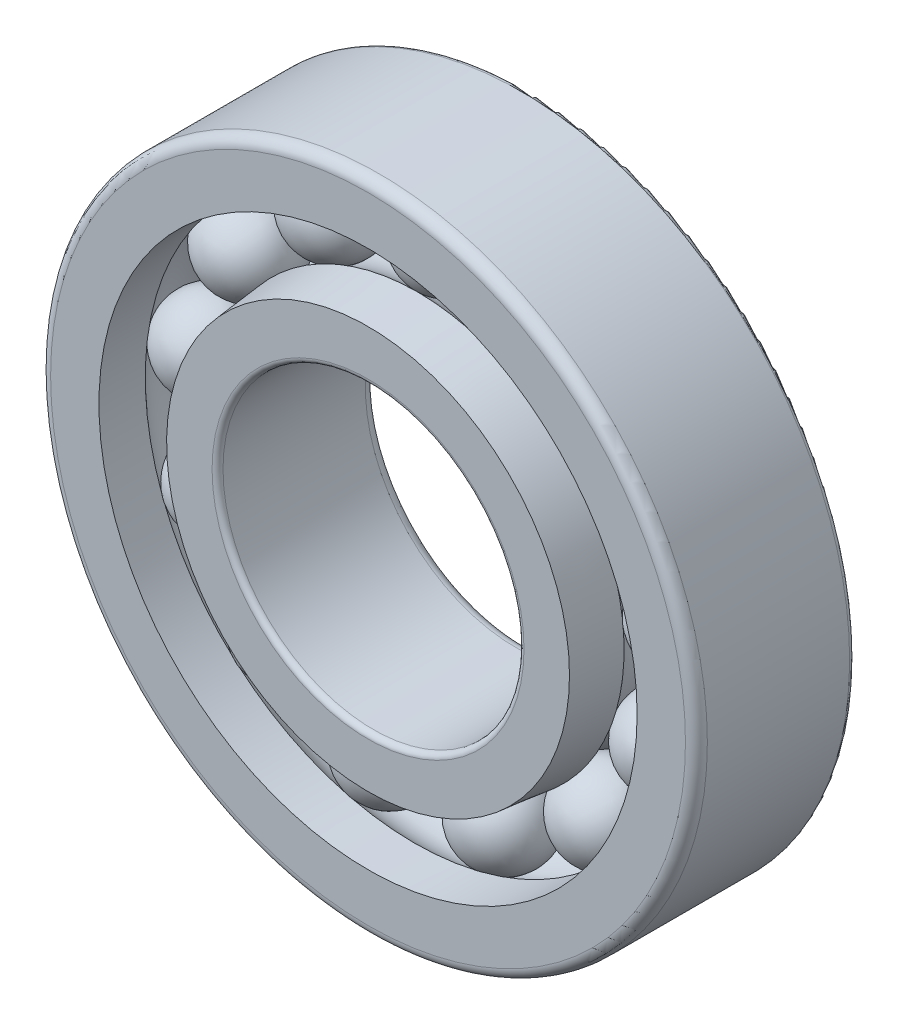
SolidWorks part; units mm, degrees
ref_plane "Front Plane" through (0, 0, 0) normal (0, 0, 1) x (1, 0, 0)
ref_plane "Top Plane" through (0, 0, 0) normal (0, 1, 0) x (1, 0, 0)
ref_plane "Right Plane" through (0, 0, 0) normal (1, 0, 0) x (0, 0, -1)
sketch "BaseSke" plane through (0, 0, 0) normal (1, 0, 0) x (0, 0, -1)
  line L0 (-47.2296, 0) -> (24.6132, 0) construction
  line L1 (-47.2296, 43.75) -> (24.6132, 43.75) construction
  line L2 (0, 129.5214) -> (0, -86.3012) construction
  line L3 (0, 51.875) -> (0, 35.625)
  line L4 (-14.5, 60) -> (14.5, 60) construction
  line L5 (-14.5, 27.5) -> (14.5, 27.5) construction
  arc A0 (0, 51.875) -> (0, 35.625) centre (0, 43.75) ccw
  dimension "Ball_diameter" = 16.25
  dimension "D1" = 43.75
  dimension "Bearing_Thickness" = 29
  dimension "Bearing_Outside_Diameter" = 120
  dimension "Bearing_Inside_Diameter" = 55
revolve "Ball" add sketch "BaseSke" angle 360 about L3
sketch "OuterRaceSke" plane through (0, 0, 0) normal (1, 0, 0) x (0, 0, -1)
  line L0 (0, 0) -> (0, 87.5396) construction
  line L1 (-14.5, 60) -> (14.5, 60)
  line L2 (-14.5, 60) -> (-14.5, 49.1667)
  line L3 (-14.5, 49.1667) -> (-6.0426, 49.1667)
  line L4 (14.5, 60) -> (14.5, 50.6907)
  line L5 (-50.3916, 0) -> (55.2197, 0) construction
  line L6 (-47.2296, 43.75) -> (24.6132, 43.75) construction
  line L8 (14.5, 50.6907) -> (5.4727, 49.7419)
  line L9 (0, 49.1667) -> (-2.5325, 58.6181) construction
  line L10 (0, 49.1667) -> (5.4727, 49.7419) construction
  arc A0 (5.4727, 49.7419) -> (-6.0426, 49.1667) centre (0, 43.75) ccw
  dimension "D4" = 16.23
  dimension "D2" = 98.3333
  dimension "D3" = 6
  dimension "Angle" = 15
revolve "OuterRace" add sketch "OuterRaceSke" angle 360 about L5
sketch "InnerRaceSke" plane through (0, 0, 0) normal (1, 0, 0) x (0, 0, -1)
  line L0 (-70.8626, 0) -> (113.5527, 0) construction
  line L1 (0, 58.441) -> (0, -70.8113) construction
  line L2 (-14.5, 27.5) -> (14.5, 27.5)
  line L3 (-14.5, 27.5) -> (-14.5, 38.3333)
  line L4 (-14.5, 38.3333) -> (-6.0426, 38.3333)
  line L5 (14.5, 27.5) -> (14.5, 38.3333)
  line L6 (0, 129.5214) -> (0, -86.3012) construction
  line L7 (6.0426, 38.3333) -> (14.5, 38.3333)
  arc A0 (-6.0426, 38.3333) -> (6.0426, 38.3333) centre (0, 43.75) ccw
  arc A1 (0, 51.875) -> (0, 35.625) centre (0, 43.75) ccw construction
  dimension "D2" = 16.23
  dimension "D1" = 76.6667
revolve "InnerRace" add sketch "InnerRaceSke" angle 360 about L0
fillet "Fillet1" radius 2 2 edges at (27.5, 0, -14.5) (60, 0, 14.5)
fillet "Fillet2" radius 1 2 edges at (60, 0, -14.5) (27.5, 0, 14.5)
sketch "CutInnerRaceSke" plane through (0, 0, 0) normal (1, 0, 0) x (0, 0, -1)
  line L0 (-6.0426, 38.3333) -> (-14.5, 38.3333)
  line L1 (-14.5, 38.3333) -> (-14.5, 36.8093)
  line L2 (-14.5, 36.8093) -> (-5.4727, 37.7581)
  line L3 (-5.4727, 37.7581) -> (0, 38.3333) construction
  line L4 (0, 58.441) -> (0, -70.8113) construction
  line L5 (-28.3066, 0) -> (35.2466, 0) construction
  arc A0 (-6.0426, 38.3333) -> (-5.4727, 37.7581) centre (0, 43.75) ccw
  arc A1 (-6.0426, 38.3333) -> (6.0426, 38.3333) centre (0, 43.75) ccw construction
  dimension "D1" = 6
revolve "CutInnerRace" cut sketch "CutInnerRaceSke" angle 360 about L5
pattern_circular "CirPatternBall" count 13 over 360 about axis through (0, 0, 0) along (0, 0, 1) of "Ball"
sketch "SimplifiedSke" plane through (0, 0, 0) normal (1, 0, 0) x (0, 0, -1)
  line L0 (37.5911, 0) -> (-37.5911, 0) construction
  circle A0 centre (0, 43.75) radius 8.125
  arc A1 (0, 51.875) -> (0, 35.625) centre (0, 43.75) ccw construction
revolve "Simplified" [suppressed] add sketch "SimplifiedSke" angle 360 about L0
equation "\"D1@BaseSke\" =  (\"Bearing_Outside_Diameter@BaseSke\"  +  \"Bearing_Inside_Diameter@BaseSke\"  )  / 4"
equation "\"Ball_diameter@BaseSke\" =  ( \"Bearing_Outside_Diameter@BaseSke\" - \"Bearing_Inside_Diameter@BaseSke\" ) / 4 "
equation "\"D2@OuterRaceSke\" = \"Bearing_Outside_Diameter@BaseSke\" -  ( \"Bearing_Outside_Diameter@BaseSke\" - \"Bearing_Inside_Diameter@BaseSke\" )  / 3"
equation "\"D4@OuterRaceSke\" = (  \"Bearing_Outside_Diameter@BaseSke\" - \"Bearing_Inside_Diameter@BaseSke\" ) / 4 -0.02"
equation "\"D3@OuterRaceSke\" = \"Angle@OuterRaceSke\"/2.5"
equation "\"D1@InnerRaceSke\" = \"Bearing_Inside_Diameter@BaseSke\" +  ( \"Bearing_Outside_Diameter@BaseSke\" - \"Bearing_Inside_Diameter@BaseSke\" )  / 3"
equation "\"D2@InnerRaceSke\" = \"D4@OuterRaceSke\""
equation "\"D1@CirPatternBall\" = int( \"D1@BaseSke\"* pi  * 2 / \"Ball_diameter@BaseSke\"/1.2 ) -1"
equation "\"D1@CutInnerRaceSke\" = \"D3@OuterRaceSke\""
